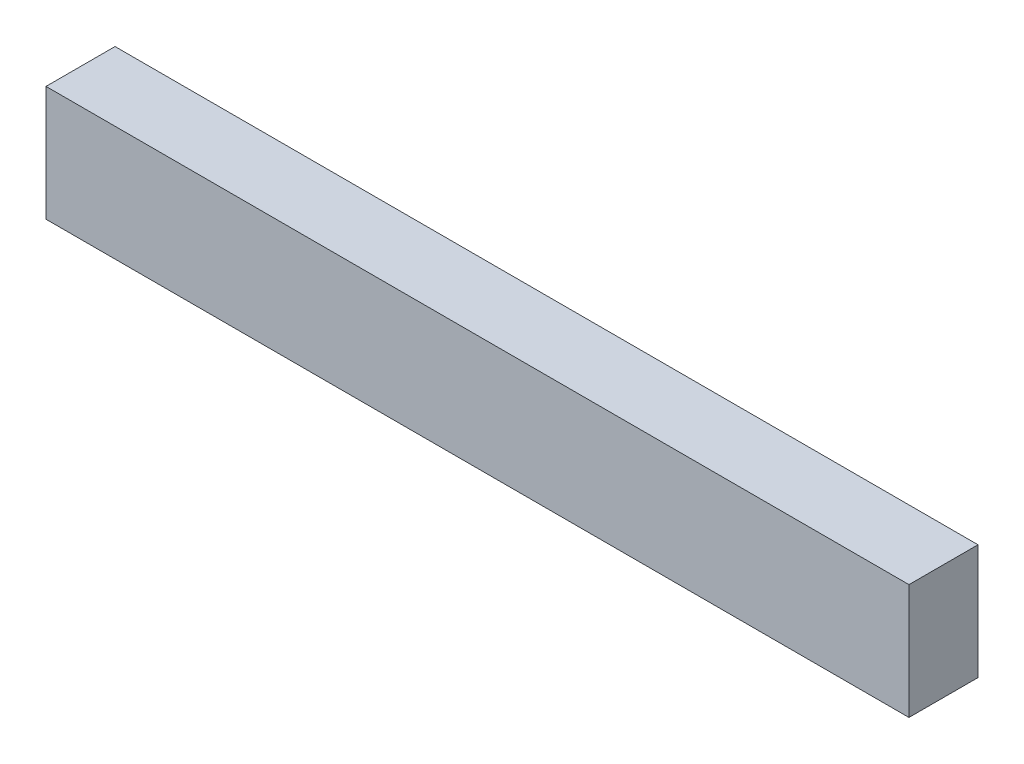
SolidWorks part; units mm, degrees
ref_plane "Front Plane" through (0, 0, 0) normal (0, 0, 1) x (1, 0, 0)
ref_plane "Top Plane" through (0, 0, 0) normal (0, 1, 0) x (1, 0, 0)
ref_plane "Right Plane" through (0, 0, 0) normal (1, 0, 0) x (0, 0, -1)
sketch "Sketch1" plane through (0, 0, 0) normal (0, 1, 0) x (1, 0, 0)
  line L1 (0, 0) -> (525, 0)
  line L2 (0, 0) -> (0, 42)
  line L3 (0, 42) -> (525, 42)
  line L4 (525, 0) -> (525, 42)
  dimension "D1" = 525
  dimension "D2" = 42
extrude "Boss-Extrude2" add sketch "Sketch1" along normal blind 70
